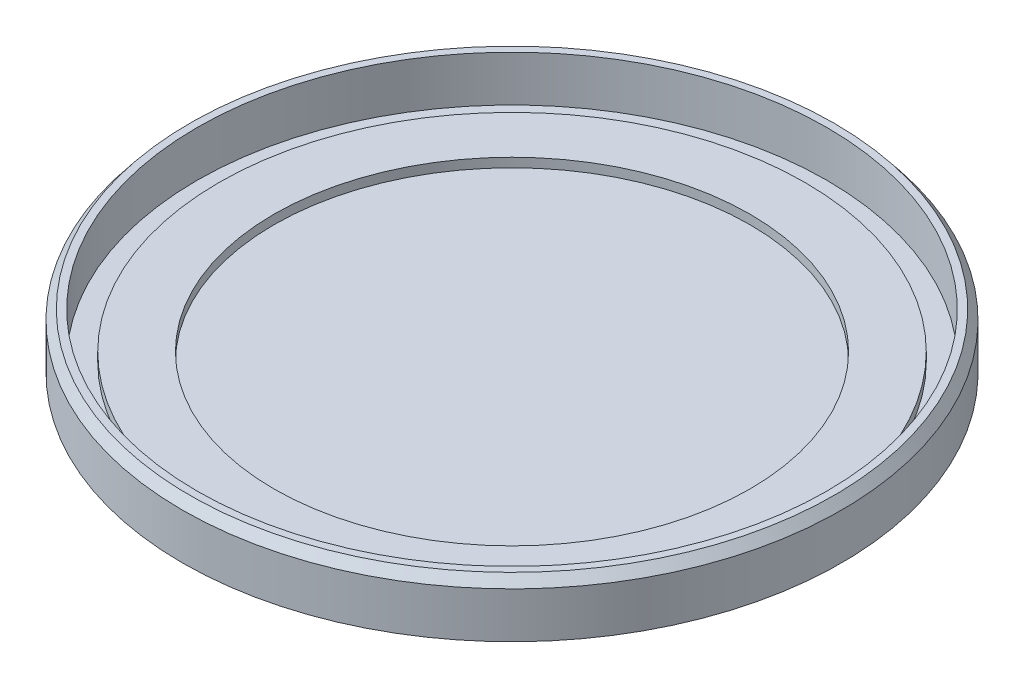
SolidWorks part; units mm, degrees
ref_plane "Front Plane" through (0, 0, 0) normal (0, 0, 1) x (1, 0, 0)
ref_plane "Top Plane" through (0, 0, 0) normal (0, 1, 0) x (1, 0, 0)
ref_plane "Right Plane" through (0, 0, 0) normal (1, 0, 0) x (0, 0, -1)
sketch "Sketch1" plane through (0, 0, 0) normal (0, 0, 1) x (1, 0, 0)
  line L0 (0, -10) -> (0, 1100) construction
  line L1 (0, 0) -> (180, 0)
  line L2 (180, 0) -> (180, 25)
  line L3 (180, 25) -> (176, 30)
  line L4 (176, 30) -> (172, 30)
  line L5 (172, 30) -> (172, 5)
  line L6 (172, 5) -> (160, 5)
  line L7 (160, 5) -> (160, 10)
  line L8 (160, 10) -> (130, 10)
  line L9 (130, 10) -> (130, 5)
  line L10 (130, 5) -> (0, 5)
  line L11 (0, 5) -> (0, 0)
revolve "Removable Drainage Saucer" add sketch "Sketch1" angle 360 about L0
